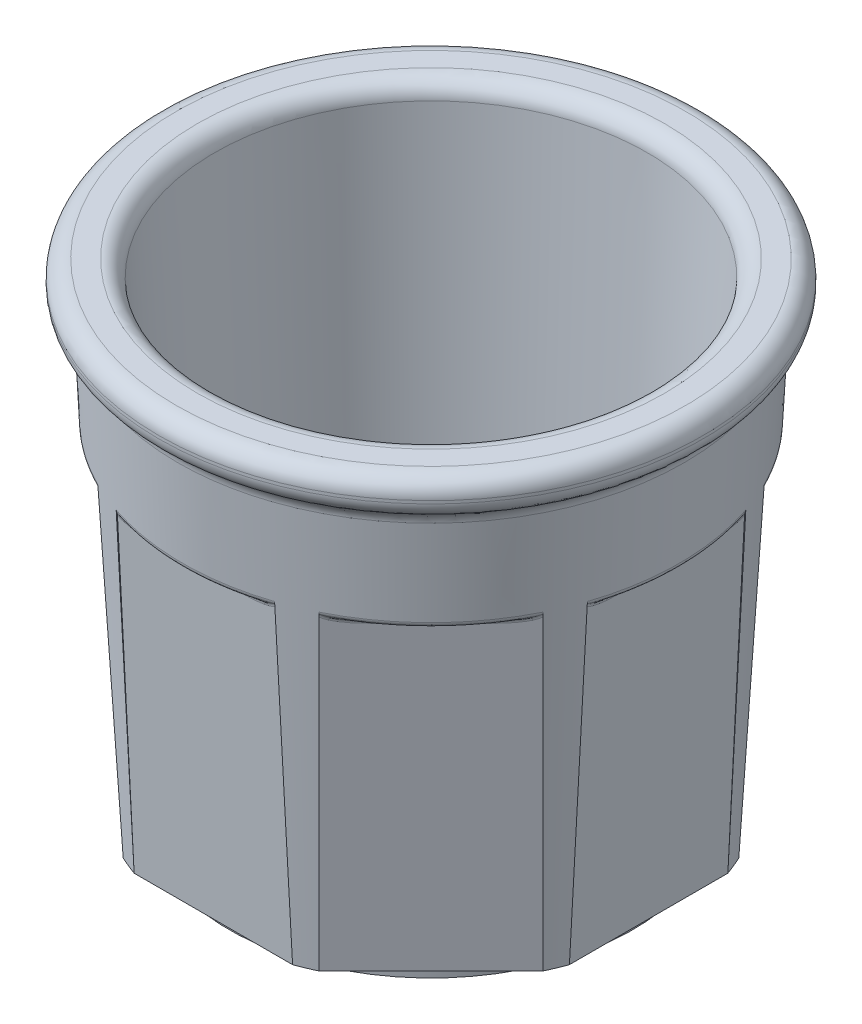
SolidWorks part; units mm, degrees
ref_plane "Plan de face" through (0, 0, 0) normal (0, 0, 1) x (1, 0, 0)
ref_plane "Plan de dessus" through (0, 0, 0) normal (0, 1, 0) x (1, 0, 0)
ref_plane "Plan de droite" through (0, 0, 0) normal (1, 0, 0) x (0, 0, -1)
sketch "Esquisse1" plane through (0, 0, 0) normal (0, 1, 0) x (1, 0, 0)
  circle A0 centre (0, 0) radius 40
  dimension "D1" = 80
extrude "Boss.-Extru.1" add sketch "Esquisse1" along normal blind 80 draft 3
sketch "Esquisse2" plane through (0, 80, 0) normal (0, 1, 0) x (1, 0, 0)
  circle A0 centre (0, 0) radius 47
  dimension "D1" = 94
extrude "Boss.-Extru.2" add sketch "Esquisse2" against normal blind 6.5
sketch "Esquisse3" plane through (0, 0, 0) normal (0, 1, 0) x (1, 0, 0)
  line L0 (-37.5877, 13.6808) -> (0, 0) construction
  line L1 (-62.2873, 13.6808) -> (-37.5877, 13.6808)
  line L2 (-62.2873, 13.6808) -> (-62.2873, -13.6808)
  line L3 (-62.2873, -13.6808) -> (-37.5877, -13.6808)
  line L4 (-37.5877, 13.6808) -> (-37.5877, -13.6808)
  line L5 (0, 0) -> (-37.5877, -13.6808) construction
  circle A1 centre (0, 0) radius 40 construction
  dimension "D1" = 40
sketch "Esquisse4" plane through (0, 0, 0) normal (0, 0, 1) x (1, 0, 0)
  line L0 (-37.5877, 0) -> (-40.4662, 54.9246)
  line L1 (-62.2873, 0) -> (-37.5877, 0) construction
  line L2 (-62.2873, 0) -> (-37.5877, 0) construction
  line L3 (-43.852, 73.5) -> (-40, 0) construction
  dimension "D1" = 55
sweep "Enlèvement de matière-Balayage1" cut profiles "Esquisse3" path "Esquisse4"
pattern_circular "Répétition circulaire1" count 8 over 360 about axis through (0, 0, 0) along (0, 1, 0) of "Enlèvement de matière-Balayage1"
fillet "Congé2" radius 3 1 edges at (0, 73.5, 47)
fillet "Congé19" radius 3 1 edges at (0, 80, 47)
fillet "Congé3" radius 3 1 edges at (0, 73.5, 43.852)
fillet "Congé11" radius 1 8 edges at (-42.8785, 54.9246, 0) (-30.3197, 54.9246, -30.3197) (0, 54.9246, -42.8785) (30.3197, 54.9246, -30.3197) (42.8785, 54.9246, 0) (30.3197, 54.9246, 30.3197) (0, 54.9246, 42.8785) (-30.3197, 54.9246, 30.3197)
sketch "Esquisse5" plane through (0, 0, 0) normal (0, -1, 0) x (1, 0, 0)
  circle A0 centre (0, 0) radius 35
  dimension "D1" = 70
extrude "Boss.-Extru.3" add sketch "Esquisse5" along normal blind 3 draft 3
fillet "Congé14" radius 1 1 edges at (0, 0, 35)
fillet "Congé22" radius 1 4 edges at (28.6139, 54.9246, 28.6139) (37.4231, 55.0144, 19.8114) (19.4421, 55.1077, 37.7993) (19.064, 55.621, 38.4116)
fillet "Congé23" radius 1 4 edges at (0, 54.9246, 40.4662) (12.4534, 55.0144, 40.4709) (-12.9805, 55.1077, 40.4758) (-13.6808, 55.621, 40.6414)
fillet "Congé24" radius 1 4 edges at (-28.6139, 54.9246, 28.6139) (-19.8114, 55.0144, 37.4231) (-37.7993, 55.1077, 19.4421) (-38.4116, 55.621, 19.064)
fillet "Congé25" radius 1 4 edges at (-40.4662, 54.9246, 0) (-40.4709, 55.0144, 12.4534) (-40.4758, 55.1077, -12.9805) (-40.6414, 55.621, -13.6808)
fillet "Congé26" radius 1 4 edges at (-28.6139, 54.9246, -28.6139) (-37.4231, 55.0144, -19.8114) (-19.4421, 55.1077, -37.7993) (-19.064, 55.621, -38.4116)
fillet "Congé27" radius 1 4 edges at (0, 54.9246, -40.4662) (-12.4534, 55.0144, -40.4709) (12.9805, 55.1077, -40.4758) (13.6808, 55.621, -40.6414)
fillet "Congé28" radius 1 4 edges at (28.6139, 54.9246, -28.6139) (19.8114, 55.0144, -37.4231) (37.7993, 55.1077, -19.4421) (38.4116, 55.621, -19.064)
fillet "Congé29" radius 1 4 edges at (40.4662, 54.9246, 0) (40.4709, 55.0144, -12.4534) (40.4758, 55.1077, 12.9805) (40.6414, 55.621, 13.6808)
sketch "Esquisse6" plane through (0, -3, 0) normal (0, -1, 0) x (1, 0, 0)
  circle A0 centre (0, 0) radius 30
  dimension "D1" = 60
extrude "Enlèv. mat.-Extru.3" cut sketch "Esquisse6" against normal blind 3
fillet "Congé17" radius 3 1 edges at (0, 0, -30)
sketch "Esquisse7" plane through (0, 80, 0) normal (0, 1, 0) x (1, 0, 0)
  circle A0 centre (0, 0) radius 37.5
  dimension "D1" = 75
extrude "Enlèv. mat.-Extru.4" cut sketch "Esquisse7" against normal blind 76 draft 3
fillet "Congé18" radius 3 1 edges at (0, 4, 33.517)
fillet "Congé20" radius 3 1 edges at (0, 80, 37.5)
